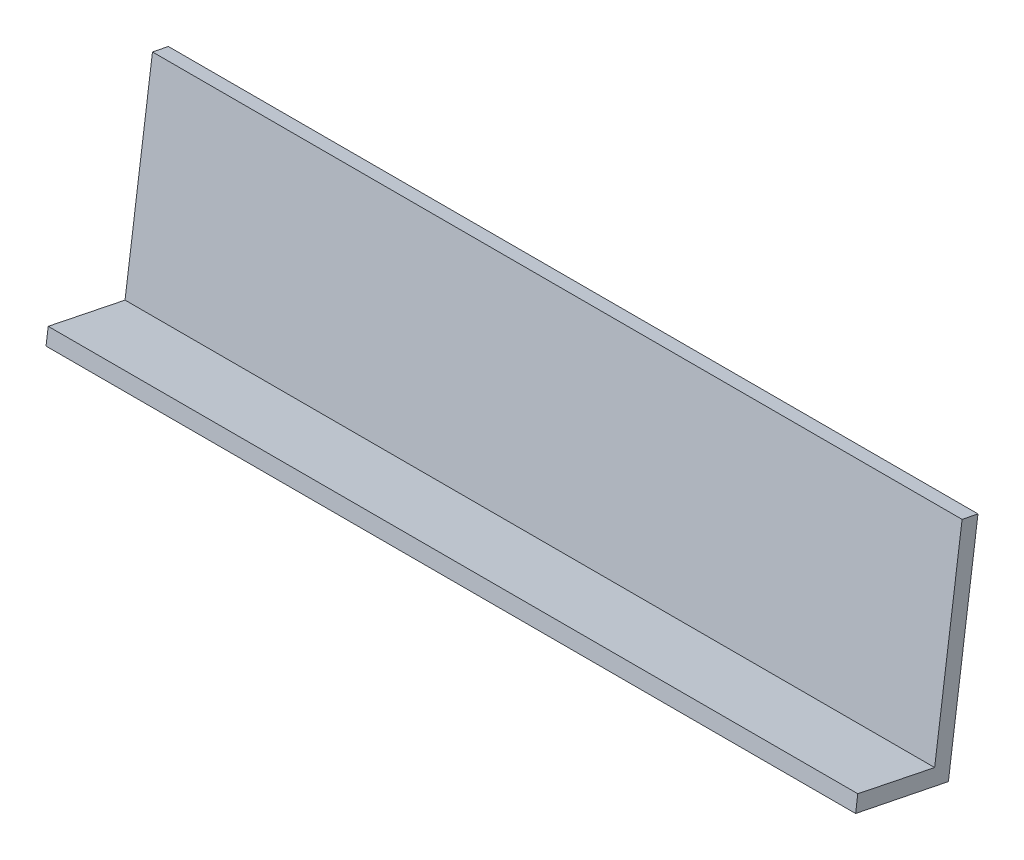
SolidWorks part; units mm, degrees
ref_plane "Plano frontal" through (0, 0, 0) normal (0, 0, 1) x (1, 0, 0)
ref_plane "Plano superior" through (0, 0, 0) normal (0, 1, 0) x (1, 0, 0)
ref_plane "Plano direito" through (0, 0, 0) normal (1, 0, 0) x (0, 0, -1)
sketch "Esboço3" plane through (0, 0, 0) normal (1, 0, 0) x (0, 0, -1)
  line L0 (14.4, -133.2276) -> (-6746.0242, -49674.0861) construction
  line L1 (21.0005, -84.8588) -> (10.1834, -164.1273) construction
  line L2 (10.1834, -164.1273) -> (32.1318, -3.2878)
  line L3 (-83.8854, -145.1161) -> (-70.3554, -147.8505) construction
  line L4 (-54.9572, -123.763) -> (-6815.3814, -49664.6215) construction
  line L5 (21.0005, -84.8588) -> (-6739.4237, -49625.7173) construction
  line L6 (-56.9474, -138.3474) -> (0, -150)
  line L7 (32.1318, -3.2878) -> (20.3456, -0.9059)
  line L8 (10.1834, -164.1273) -> (-58.5693, -150.2325)
  line L10 (9.1107, -83.2363) -> (-6751.3135, -49624.0948) construction
  line L11 (-56.9474, -138.3474) -> (-58.5693, -150.2325)
  line L12 (-85.074, -150.9972) -> (48924.0763, -10055.7016) construction
  line L13 (-56.9435, -138.3184) -> (48927.642, -10038.0584) construction
  line L14 (-81.5083, -133.3539) -> (48927.642, -10038.0584) construction
  line L15 (0, -150) -> (20.3456, -0.9059)
  line L16 (-58.5693, -150.2325) -> (48925.2649, -10049.8206) construction
  line L17 (-51.7941, 13.6735) -> (48957.3561, -9891.0309) construction
  line L18 (-83.8854, -145.1161) -> (48925.2649, -10049.8206) construction
  line L19 (-81.5083, -133.3539) -> (-68.7296, -135.9365) construction
  dimension "D2" = 12
  dimension "D1" = 70
  dimension "D3" = 12
  dimension "D4" = 168
  dimension "D6" = 18
extrude "Ressalto-extrusão3" add sketch "Esboço3" along normal blind 600 contours L6 L15 L7 L2 L8 L11
